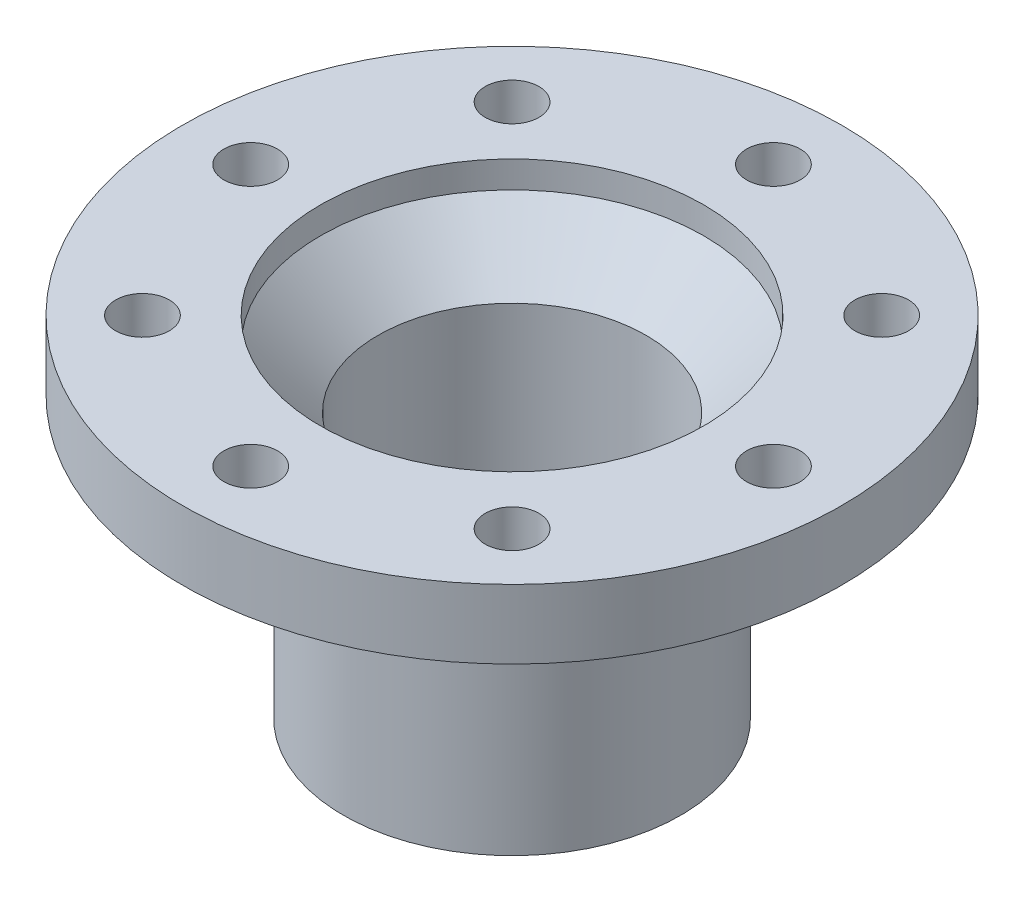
SolidWorks part; units mm, degrees
ref_plane "Alzado" through (0, 0, 0) normal (0, 0, 1) x (1, 0, 0)
ref_plane "Planta" through (0, 0, 0) normal (0, 1, 0) x (1, 0, 0)
ref_plane "Vista lateral" through (0, 0, 0) normal (1, 0, 0) x (0, 0, -1)
sketch "Croquis1" plane through (0, 0, 0) normal (0, 0, 1) x (1, 0, 0)
  line L0 (17.5, 22.9826) -> (17.5, -11.5174)
  line L1 (17.5, -11.5174) -> (22, -11.5174)
  line L2 (22, -11.5174) -> (22, 21.9826)
  line L3 (22, 21.9826) -> (25, 24.9826)
  line L4 (25, 24.9826) -> (43, 24.9826)
  line L5 (43, 24.9826) -> (43, 33.9826)
  line L6 (43, 33.9826) -> (25, 33.9826)
  line L7 (25, 33.9826) -> (25, 30.4826)
  line L8 (25, 30.4826) -> (17.5, 22.9826)
  line L9 (0, 0) -> (0, 36.8374) construction
  dimension "D1" = 4.5
  dimension "D2" = 36.5
  dimension "D3" = 21
  dimension "D4" = 18
  dimension "D5" = 9
  dimension "D6" = 135
  dimension "D7" = 18
  dimension "D8" = 3.5
  dimension "D9" = 17.5
revolve "Revolución1" add sketch "Croquis1" angle 360 about L9
sketch "Croquis2" plane through (0, 33.9826, 0) normal (0, 1, 0) x (1, 0, 0)
  circle A0 centre (0, 34.1) radius 3.5
  dimension "D2" = 7
  dimension "D1" = 34.1
  dimension "D3" = 0
extrude "Cortar-Extruir1" cut sketch "Croquis2" against normal blind 10
pattern_circular "MatrizC1" count 8 over 360 about axis through (0, 0, 0) along (0, 1, 0) of "Cortar-Extruir1"
